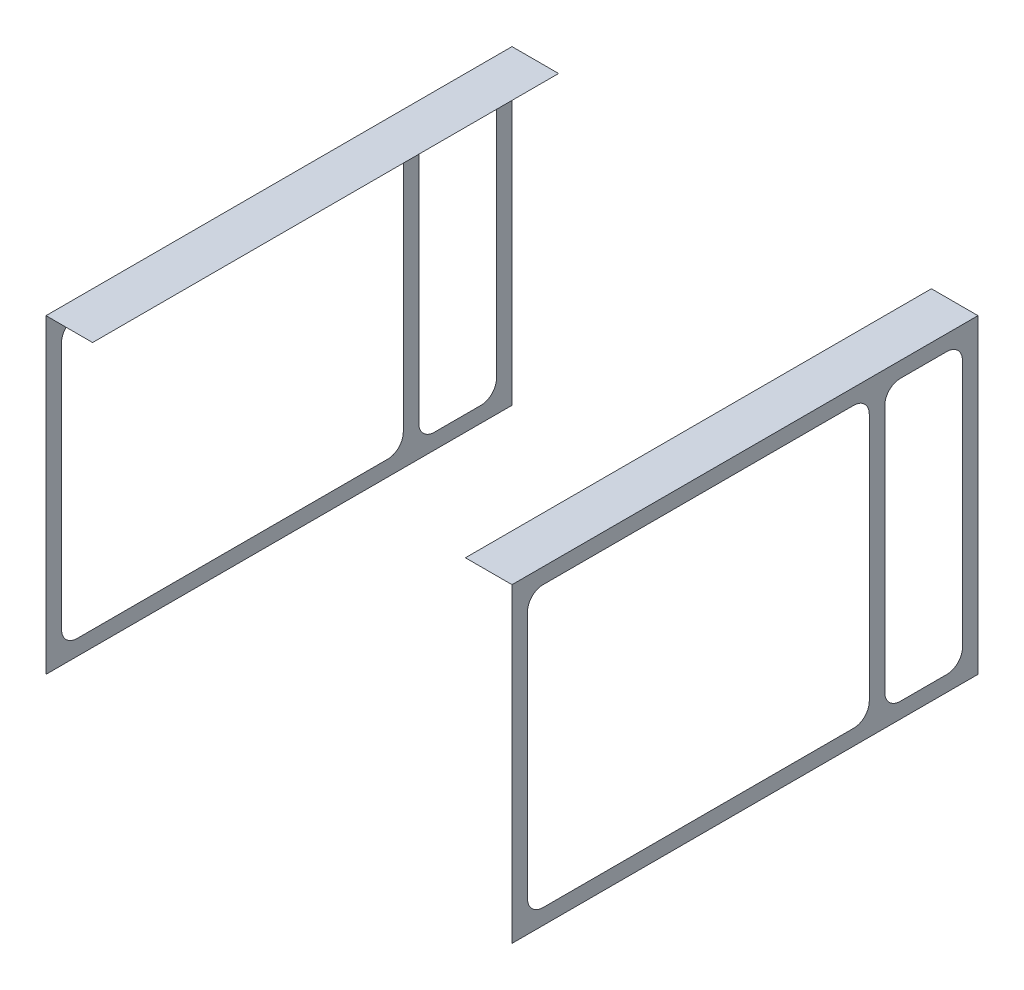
SolidWorks part; units mm, degrees
ref_plane "Alzado" through (0, 0, 0) normal (0, 0, 1) x (1, 0, 0)
ref_plane "Planta" through (0, 0, 0) normal (0, 1, 0) x (1, 0, 0)
ref_plane "Vista lateral" through (0, 0, 0) normal (1, 0, 0) x (0, 0, -1)
sketch "Croquis1" plane through (0, 0, 0) normal (0, 0, 1) x (1, 0, 0)
  line L0 (-150, -142.6082) -> (-150, 57.3918)
  line L1 (-150, 57.3918) -> (-120, 57.3918)
  line L2 (0, 74.2775) -> (0, -31.1966) construction
  line L3 (150, 57.3918) -> (120, 57.3918)
  line L4 (150, -142.6082) -> (150, 57.3918)
  dimension "D1" = 200
  dimension "D2" = 30
  dimension "D3" = 150
surface "Superficie-Extruir1" sketch "Croquis1" parameters "D1"=300
sketch "Croquis2" plane through (150, 0, 0) normal (1, 0, 0) x (0, 0, -1)
  line L4 (-50, -132.6082) -> (-20, -132.6082)
  line L5 (-70, 37.3918) -> (-70, -122.6082)
  line L6 (-60, 37.3918) -> (-60, -122.6082)
  line L7 (-80, 47.3918) -> (-280, 47.3918)
  line L8 (-290, 47.3918) -> (-290, -132.6082)
  line L9 (-290, -132.6082) -> (-10, -132.6082)
  line L10 (-10, -132.6082) -> (-10, 47.3918)
  line L11 (-10, 47.3918) -> (-290, 47.3918)
  line L12 (-290, 37.3918) -> (-290, -122.6082)
  line L13 (-280, -132.6082) -> (-80, -132.6082)
  line L14 (-10, -122.6082) -> (-10, 37.3918)
  line L15 (-20, 47.3918) -> (-50, 47.3918)
  arc A0 (-280, -132.6082) -> (-290, -122.6082) centre (-280, -122.6082) cw
  arc A1 (-290, 37.3918) -> (-280, 47.3918) centre (-280, 37.3918) cw
  arc A2 (-10, 37.3918) -> (-20, 47.3918) centre (-20, 37.3918) ccw
  arc A3 (-20, -132.6082) -> (-10, -122.6082) centre (-20, -122.6082) ccw
  arc A4 (-50, -132.6082) -> (-60, -122.6082) centre (-50, -122.6082) cw
  arc A5 (-80, -132.6082) -> (-70, -122.6082) centre (-80, -122.6082) ccw
  arc A6 (-70, 37.3918) -> (-80, 47.3918) centre (-80, 37.3918) ccw
  arc A7 (-60, 37.3918) -> (-50, 47.3918) centre (-50, 37.3918) cw
  dimension "D2" = 10
  dimension "D1" = 10
surface "Superficie-Recortar1"
